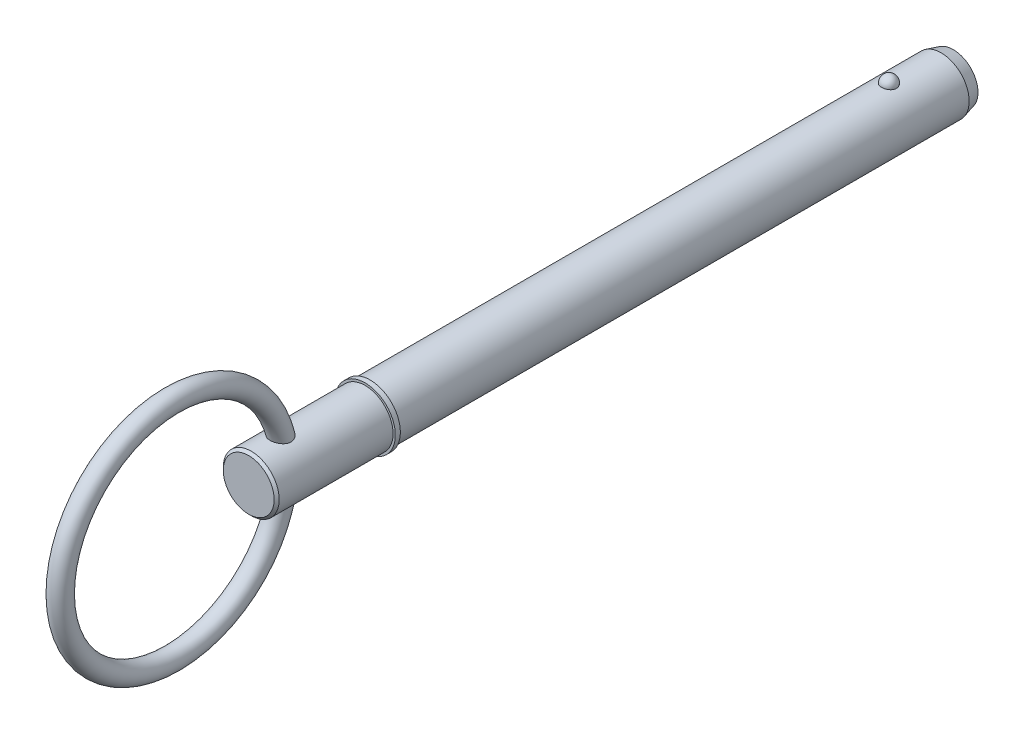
SolidWorks part; units mm, degrees
ref_plane "Front Plane" through (0, 0, 0) normal (0, 0, 1) x (1, 0, 0)
ref_plane "Top Plane" through (0, 0, 0) normal (0, 1, 0) x (1, 0, 0)
ref_plane "Right Plane" through (0, 0, 0) normal (1, 0, 0) x (0, 0, -1)
sketch "Sketch2" plane through (0, 0, 0) normal (0, 0, 1) x (1, 0, 0)
  circle A0 centre (0, 0) radius 5.555
  point P3 (0, 5.555)
  dimension "D1" = 11.11
extrude "Boss-Extrude1" add sketch "Sketch2" along normal blind 101.6
sketch "Sketch3" plane through (0, 0, 0) normal (0, 0, -1) x (-1, 0, 0)
  circle A0 centre (0, 0) radius 5.555
  dimension "D1" = 11.11
extrude "Boss-Extrude2" add sketch "Sketch3" along normal blind 14.27
chamfer "Chamfer1" distance 2.4 angle 15 1 edges at (-5.555, 0, -14.27)
sketch "Sketch18" plane through (0, 0, 0) normal (1, 0, 0) x (0, 0, -1)
  line L0 (11.87, 5.555) -> (-101.6, 5.555) construction
  line L1 (1.49, 7.045) -> (1.49, 4.065)
  line L2 (-101.6, -5.555) -> (11.87, -5.555) construction
  arc A0 (1.49, 7.045) -> (1.49, 4.065) centre (1.49, 5.555) ccw
  point P4 (0, 5.555)
  dimension "D1" = 12.6
revolve "Revolve1" add sketch "Sketch18" angle 360 about L1
sketch "Sketch19" plane through (0, 0, 0) normal (1, 0, 0) x (0, 0, -1)
  line L0 (-33.7288, 0) -> (-46.4542, 0) construction
sketch "Sketch20" plane through (0, 0, 0) normal (1, 0, 0) x (0, 0, -1)
  line L0 (-101.6, 0) -> (-101.6, 6)
  line L1 (-101.6, 5.555) -> (-101.6, -5.555) construction
  line L2 (-101.6, 6) -> (-102.6, 6)
  line L3 (-102.6, 6) -> (-102.6, 0)
  line L4 (-33.7288, 0) -> (-46.4542, 0) construction
  line L5 (-102.6, 0) -> (-101.6, 0)
  dimension "D1" = 6
  dimension "D2" = 1
revolve "Revolve2" add sketch "Sketch20" angle 360 about L0
sketch "Sketch21" plane through (0, 0, 101.6) normal (0, 0, -1) x (-1, 0, 0)
  circle A0 centre (0, 0) radius 5.555
  dimension "D1" = 11.11
extrude "Boss-Extrude3" add sketch "Sketch21" against normal blind 24.13
chamfer "Chamfer2" distance 0.5 angle 45 1 edges at (-5.555, 0, 125.73)
sketch "Sketch23" plane through (0, 0, 0) normal (1, 0, 0) x (0, 0, -1)
  line L0 (-125.73, 5.055) -> (-125.73, -5.055) construction
  circle A0 centre (-140.955, 0) radius 22.225
  point P2 (-118.73, 0)
  dimension "D1" = 44.45
  dimension "D2" = 7
sketch "Sketch24" plane through (0, 0, 0) normal (0, 1, 0) x (1, 0, 0)
  circle A0 centre (0, -118.73) radius 2
  dimension "D1" = 4
sweep "Sweep1" add profiles "Sketch24" path "Sketch23"
